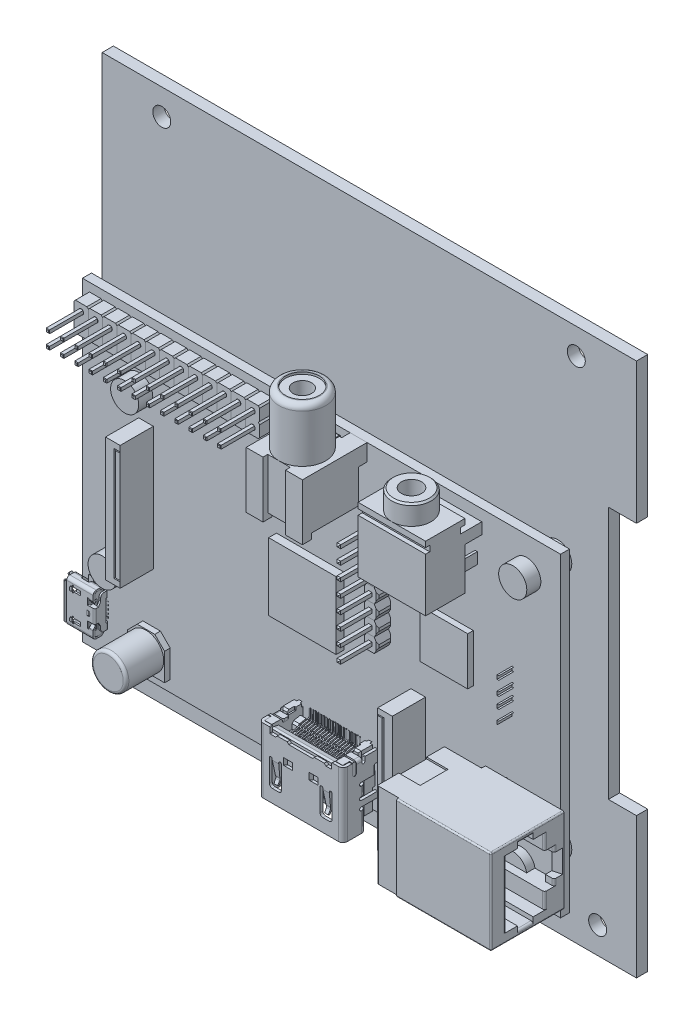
SolidWorks part; units mm, degrees
ref_plane "Front Plane" through (0, 0, 0) normal (0, 0, 1) x (1, 0, 0)
ref_plane "Top Plane" through (0, 0, 0) normal (0, 1, 0) x (1, 0, 0)
ref_plane "Right Plane" through (0, 0, 0) normal (1, 0, 0) x (0, 0, -1)
imported_body "Solid1-1-surface1"
imported_body "Solid1-1-1-surface2"
imported_body "Solid1-1-1-surface3"
imported_body "Solid1-1-1-surface4"
imported_body "Solid1-1-1-surface5"
imported_body "Solid1-2-1-surface1"
imported_body "Solid1-2-1-surface2"
imported_body "Solid1-2-1-surface3"
imported_body "Solid1-2-1-surface4"
imported_body "Solid1-2-1-surface5"
imported_body "Solid1-2-1-surface6"
imported_body "Solid1-2-1-surface7"
imported_body "Solid1-2-1-surface8"
imported_body "Solid1-2-1-surface9"
imported_body "Solid1-3-1-surface1"
imported_body "Solid1-3-1-surface2"
imported_body "Solid1-3-1-surface3"
imported_body "Solid1-3-1-surface4"
imported_body "Solid1-3-1-surface5"
imported_body "Solid1-3-1-surface6"
imported_body "Solid1-3-1-surface7"
imported_body "Solid1-3-1-surface8"
imported_body "Solid1-3-1-surface9"
imported_body "Solid1-3-1-surface10"
imported_body "Solid1-3-1-surface11"
imported_body "Solid1-3-1-surface12"
imported_body "Solid1-3-1-surface13"
imported_body "Solid1-3-1-surface14"
imported_body "Solid1-3-1-surface15"
imported_body "Solid1-3-1-surface16"
imported_body "Solid1-3-1-surface17"
imported_body "Solid1-3-1-surface18"
imported_body "Solid1-3-1-surface19"
imported_body "Solid1-3-1-surface20"
imported_body "Solid1-3-1-surface21"
imported_body "Solid1-4-1-surface1"
imported_body "Solid1-4-1-surface2"
imported_body "Solid1-4-1-surface3"
imported_body "Solid1-4-1-surface4"
imported_body "Solid1-4-1-surface5"
imported_body "Solid1-4-2-surface1"
imported_body "Solid1-4-2-surface2"
imported_body "Solid1-4-2-surface3"
imported_body "Solid1-4-2-surface4"
imported_body "Solid1-4-2-surface5"
imported_body "Solid1-4-3-surface1"
imported_body "Solid1-4-3-surface2"
imported_body "Solid1-4-3-surface3"
imported_body "Solid1-4-3-surface4"
imported_body "Solid1-4-3-surface5"
imported_body "Solid1-4-4-surface1"
imported_body "Solid1-4-4-surface2"
imported_body "Solid1-4-4-surface3"
imported_body "Solid1-4-4-surface4"
imported_body "Solid1-4-4-surface5"
imported_body "Solid1-4-5-surface1"
imported_body "Solid1-4-5-surface2"
imported_body "Solid1-4-5-surface3"
imported_body "Solid1-4-5-surface4"
imported_body "Solid1-4-5-surface5"
imported_body "Solid1-4-6-surface1"
imported_body "Solid1-4-6-surface2"
imported_body "Solid1-4-6-surface3"
imported_body "Solid1-4-6-surface4"
imported_body "Solid1-4-6-surface5"
imported_body "Solid1-4-7-surface1"
imported_body "Solid1-4-7-surface2"
imported_body "Solid1-4-7-surface3"
imported_body "Solid1-4-7-surface4"
imported_body "Solid1-4-7-surface5"
imported_body "Solid1-4-8-surface1"
imported_body "Solid1-4-8-surface2"
imported_body "Solid1-4-8-surface3"
imported_body "Solid1-4-8-surface4"
imported_body "Solid1-4-8-surface5"
imported_body "Solid1-4-9-surface1"
imported_body "Solid1-4-9-surface2"
imported_body "Solid1-4-9-surface3"
imported_body "Solid1-4-9-surface4"
imported_body "Solid1-4-9-surface5"
imported_body "Solid1-4-10-surface1"
imported_body "Solid1-4-10-surface2"
imported_body "Solid1-4-10-surface3"
imported_body "Solid1-4-10-surface4"
imported_body "Solid1-4-10-surface5"
imported_body "Solid1-4-11-surface1"
imported_body "Solid1-4-11-surface2"
imported_body "Solid1-4-11-surface3"
imported_body "Solid1-4-11-surface4"
imported_body "Solid1-4-11-surface5"
imported_body "Solid1-4-12-surface1"
imported_body "Solid1-4-12-surface2"
imported_body "Solid1-4-12-surface3"
imported_body "Solid1-4-12-surface4"
imported_body "Solid1-4-12-surface5"
imported_body "Solid1-4-13-surface1"
imported_body "Solid1-4-13-surface2"
imported_body "Solid1-4-13-surface3"
imported_body "Solid1-4-13-surface4"
imported_body "Solid1-5-1-surface1"
imported_body "Solid1-5-1-surface2"
imported_body "Solid1-6-1-surface1"
imported_body "Solid1-6-1-surface2"
imported_body "Solid1-6-1-surface3"
imported_body "Solid1-6-1-surface4"
imported_body "Solid1-6-1-surface5"
imported_body "Solid1-6-1-surface6"
imported_body "Solid1-6-1-surface7"
imported_body "Solid1-6-1-surface8"
imported_body "Solid1-6-1-surface9"
imported_body "Solid1-6-1-surface10"
imported_body "Solid1-6-1-surface11"
imported_body "Solid1-6-1-surface12"
imported_body "Solid1-7-1-surface1"
imported_body "Solid1-7-1-surface2"
imported_body "Solid1-7-1-surface3"
imported_body "Solid1-7-1-surface4"
imported_body "Solid1-7-1-surface5"
imported_body "Solid1-7-1-surface6"
imported_body "Solid1-8-1-surface1"
imported_body "Solid1-8-1-surface2"
imported_body "Solid1-8-2-surface1"
imported_body "Solid1-8-2-surface2"
imported_body "Solid1-8-3-surface1"
imported_body "Solid1-8-3-surface2"
imported_body "Solid1-8-4-surface1"
imported_body "Solid1-8-4-surface2"
imported_body "Solid1-8-5-surface1"
imported_body "Solid1-8-5-surface2"
imported_body "Solid1-8-6-surface1"
imported_body "Solid1-8-6-surface2"
imported_body "Solid1-8-7-surface1"
imported_body "Solid1-8-7-surface2"
imported_body "Solid1-8-8-surface1"
imported_body "Solid1-8-8-surface2"
imported_body "Solid1-9-1-surface1"
imported_body "Solid1-10-1-surface1"
imported_body "Solid1-10-2-surface1"
imported_body "Solid1-11-1-surface1"
imported_body "Solid1-12-1-surface1"
sketch "Sketch1" plane through (0, 0, 4.1) normal (0, 0, 1) x (1, 0, 0)
  line L0 (42.5, 28) -> (42.5, -28) construction
  line L1 (-42.5, 28) -> (42.5, 28) construction
  line L2 (-42.5, -28) -> (-42.5, 28) construction
  line L3 (42.5, -28) -> (-42.5, -28) construction
  circle A0 centre (36.5, 22) radius 2.5
  circle A1 centre (-32.5, 16) radius 2.5
  circle A2 centre (-36.5, -13) radius 2.5
  circle A3 centre (36.5, -22) radius 2.5
  dimension "D1" = 5
  dimension "D2" = 5
  dimension "D3" = 5
  dimension "D4" = 5
  dimension "D5" = 6
  dimension "D6" = 6
  dimension "D7" = 10
  dimension "D8" = 12
  dimension "D9" = 6
  dimension "D10" = 15
  dimension "D11" = 6
  dimension "D12" = 6
extrude "Boss-Extrude1" add sketch "Sketch1" against normal blind 8
sketch "Sketch2" plane through (0, 0, -3.9) normal (0, 0, -1) x (-1, 0, 0)
  line L0 (-42.5, 28) -> (-42.5, -28) construction
  line L1 (-50.5, 59) -> (44.5, 59)
  line L2 (-50.5, 59) -> (-50.5, -36)
  line L3 (-50.5, -36) -> (44.5, -36)
  line L4 (44.5, 59) -> (44.5, -36)
  line L5 (-42.5, -28) -> (42.5, -28) construction
  dimension "D1" = 95
  dimension "D2" = 95
  dimension "D3" = 8
  dimension "D4" = 8
extrude "Boss-Extrude2" add sketch "Sketch2" along normal blind 2
hole_wizard "Ø3.2 (3.2) Diameter Hole1" positions "Sketch4" profile "Sketch3" hole size "Ø3.2" standard "ISO"
sketch "Sketch4" plane through (0, 0, -5.9) normal (0, 0, -1) x (-1, 0, 0)
  line L0 (44.5, 59) -> (-50.5, 59) construction
  line L1 (-50.5, 59) -> (-50.5, -36) construction
  line L2 (44.5, -36) -> (44.5, 59) construction
  line L3 (-50.5, -36) -> (44.5, -36) construction
  point P0 (-39.8, 54.4)
  point P2 (33.9, 54.4)
  point P4 (36.4, -31.3)
  point P6 (-43.6, -31.3)
  dimension "D1" = 4.6
  dimension "D2" = 10.7
  dimension "D3" = 4.6
  dimension "D4" = 10.6
  dimension "D5" = 6.9
  dimension "D6" = 4.7
  dimension "D7" = 4.7
  dimension "D8" = 8.1
sketch "Sketch3" plane through (39.8, 54.4, -5.9) normal (1, 0, 0) x (0, 1, 0)
  line L0 (0, 0) -> (0, 10)
  line L1 (0, 10) -> (1.6, 10)
  line L2 (1.6, 10) -> (1.6, 0)
  line L5 (1.6, 0) -> (0, 0)
  line L11 (0, -6.35) -> (0, 107.95) construction
  dimension "Thru Hole Dia." = 3.2
  dimension "Thru Hole Depth" = 10
sketch "Sketch6" plane through (0, 0, -3.9) normal (0, 0, 1) x (1, 0, 0)
  line L0 (50.5, 59) -> (50.5, -36) construction
  line L1 (50.5, -11) -> (45.5, -11)
  line L2 (50.5, -11) -> (50.5, 34)
  line L3 (50.5, 34) -> (45.5, 34)
  line L4 (45.5, -11) -> (45.5, 34)
  line L5 (50.5, -36) -> (-44.5, -36) construction
  line L6 (-44.5, 59) -> (50.5, 59) construction
  dimension "D1" = 25
  dimension "D2" = 25
  dimension "D3" = 5
extrude "Cut-Extrude1" cut sketch "Sketch6" against normal blind 10
